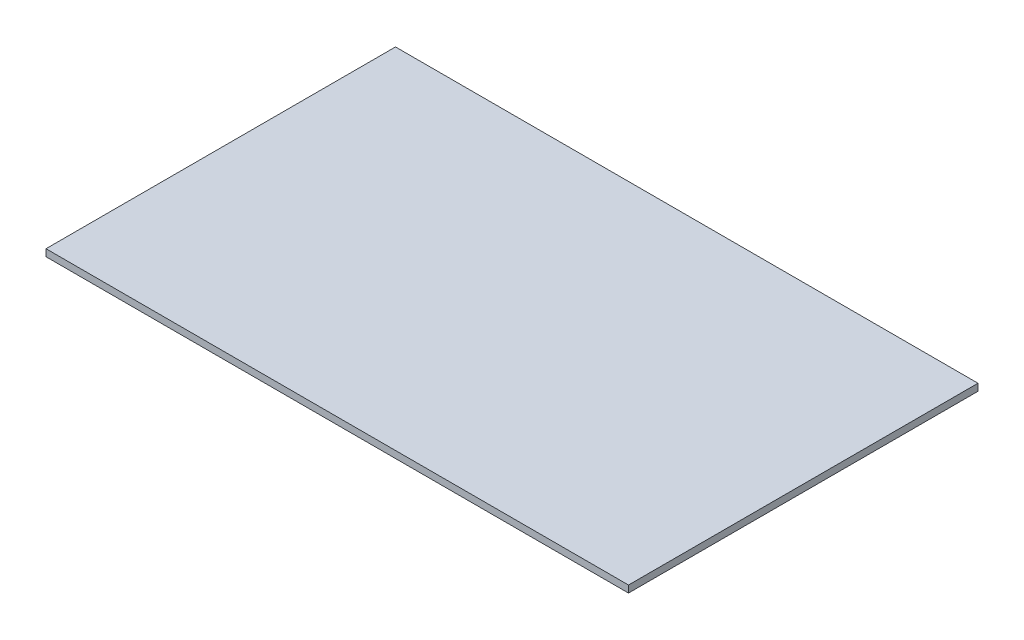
SolidWorks part; units mm, degrees
ref_plane "Front Plane" through (0, 0, 0) normal (0, 0, 1) x (1, 0, 0)
ref_plane "Top Plane" through (0, 0, 0) normal (0, 1, 0) x (1, 0, 0)
ref_plane "Right Plane" through (0, 0, 0) normal (1, 0, 0) x (0, 0, -1)
sketch "Sketch1" plane through (0, 0, 0) normal (0, 1, 0) x (1, 0, 0)
  line L1 (-762, 457.2) -> (762, 457.2)
  line L2 (-762, 457.2) -> (-762, -457.2)
  line L3 (-762, -457.2) -> (762, -457.2)
  line L4 (762, 457.2) -> (762, -457.2)
  line L5 (-762, 457.2) -> (762, -457.2) construction
  line L6 (-762, -457.2) -> (762, 457.2) construction
  point P0 (0, 0)
  dimension "D1" = 1524
  dimension "D2" = 914.4
extrude "Boss-Extrude1" add sketch "Sketch1" along normal blind 18.2562
